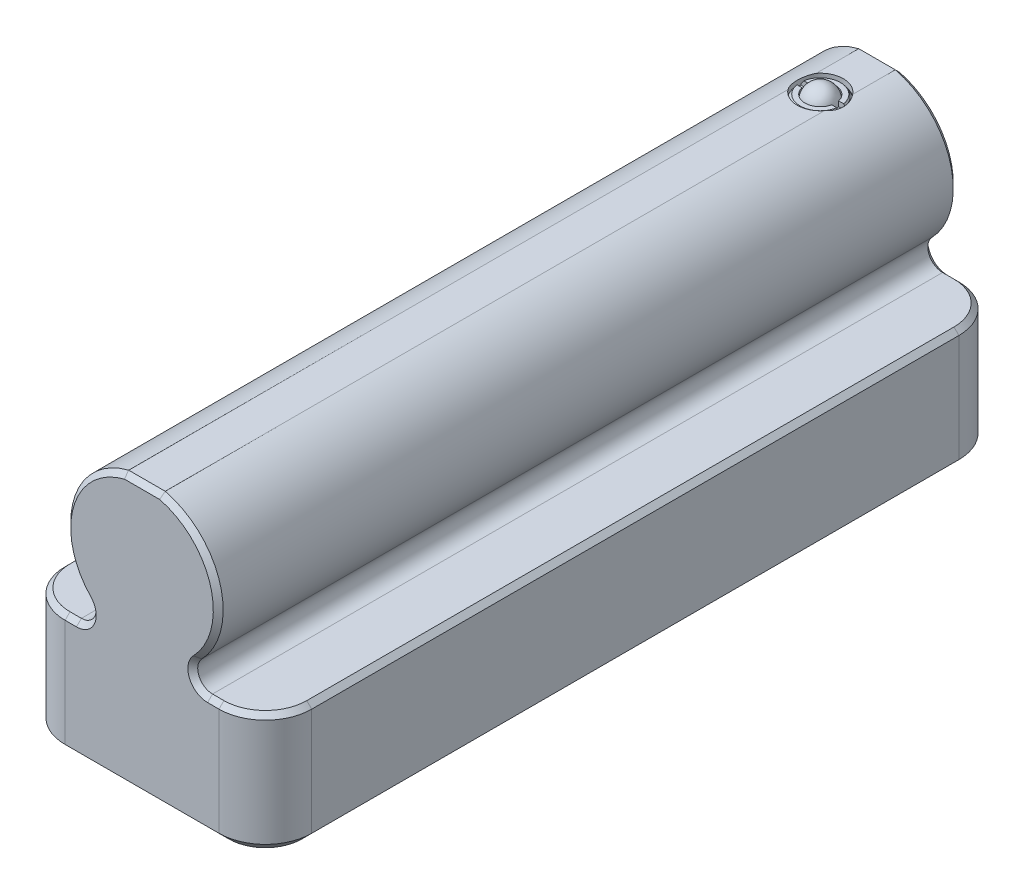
SolidWorks part; units mm, degrees
other "<4-48 DETENT>-<Imported1>"
other "<4-48 DETENT>-<Imported2>"
ref_plane "Front Plane" through (0, 0, 0) normal (0, 0, 1) x (1, 0, 0)
ref_plane "Top Plane" through (0, 0, 0) normal (0, 1, 0) x (1, 0, 0)
ref_plane "Right Plane" through (0, 0, 0) normal (1, 0, 0) x (0, 0, -1)
sketch "Sketch1" plane through (0, 0, 0) normal (0, 0, 1) x (1, 0, 0)
  line L0 (-6.35, 0) -> (-6.35, 6.2992)
  line L1 (-6.35, 6.2992) -> (-3.3751, 6.2992)
  line L2 (3.3751, 6.2992) -> (6.35, 6.2992)
  line L3 (6.35, 6.2992) -> (6.35, 0)
  line L4 (6.35, 0) -> (-6.35, 0)
  line L5 (0, 0) -> (0, 10.3124) construction
  line L7 (-0.9402, 14.1224) -> (0.9402, 14.1224)
  arc A0 (-3.3751, 6.2992) -> (-2.8263, 7.5899) centre (-3.3751, 7.0612) ccw
  arc A1 (-2.8263, 7.5899) -> (-0.9402, 14.1224) centre (0, 10.3124) cw
  arc A2 (2.8263, 7.5899) -> (3.3751, 6.2992) centre (3.3751, 7.0612) ccw
  arc A3 (0.9402, 14.1224) -> (2.8263, 7.5899) centre (0, 10.3124) cw
  dimension "D3" = 3.9243
  dimension "D4" = 14.1224
  dimension "D5" = 0.762
  dimension "D6" = 5.2261
  dimension "D1" = 6.2992
  dimension "D2" = 12.7
  dimension "D8" = 1.8805
  dimension "D9" = 4.0132
extrude "Boss-Extrude1" add sketch "Sketch1" along normal mid plane 38.1
fillet "Fillet1" radius 2.3876 4 edges at (-6.35, 3.1496, -19.05) (-6.35, 3.1496, 19.05) (6.35, 3.1496, -19.05) (6.35, 3.1496, 19.05)
chamfer "Chamfer1" distance 0.508 angle 45 8 edges at (0, 0, -19.05) (-5.6507, 0, -18.3507) (5.6507, 0, -18.3507) (-6.35, 0, 0) (6.35, 0, 0) (-5.6507, 0, 18.3507) (5.6507, 0, 18.3507) (0, 0, 19.05)
chamfer "Chamfer2" distance 0.254 angle 45 20 edges at (-5.6507, 6.2992, -18.3507) (-6.35, 6.2992, 0) (-3.6687, 6.2992, -19.05) (-5.6507, 6.2992, 18.3507) (-2.6738, 6.763, -19.05) (-3.6687, 6.2992, 19.05) (-3.7703, 11.4009, -19.05) (-2.6738, 6.763, 19.05) (2.6738, 6.763, -19.05) (-3.7703, 11.4009, 19.05) (3.6687, 6.2992, -19.05) (2.6738, 6.763, 19.05) (5.6507, 6.2992, -18.3507) (3.6687, 6.2992, 19.05) (6.35, 6.2992, 0) (5.6507, 6.2992, 18.3507) (0, 14.1224, 19.05) (0, 14.1224, -19.05) (3.7703, 11.4009, -19.05) (3.7703, 11.4009, 19.05)
hole_wizard "#10-32 Tapped Hole1" positions "Sketch2" profile "Sketch3" tap size "#10-32" standard "ANSI Inch"
sketch "Sketch2" plane through (0, 0, 0) normal (0, -1, 0) x (-1, 0, 0)
  line L0 (4.5244, 0) -> (-0.5669, 0) construction
  point P0 (0, 12.7)
  point P12 (0, -12.7)
  dimension "D1" = 12.7
sketch "Sketch3" plane through (0, 0, -12.7) normal (1, 0, 0) x (0, 0, -1)
  line L0 (0, 0) -> (0, 8.8333)
  line L1 (0, 8.8333) -> (2.0193, 7.62)
  line L2 (2.0193, 7.62) -> (2.0193, 0)
  line L5 (2.0193, 0) -> (0, 0)
  line L10 (0, 8.8333) -> (-2.0193, 7.62) construction
  line L11 (0, -6.35) -> (0, 107.95) construction
  dimension "Tap Drill Dia." = 4.0386
  dimension "Tap Drill Depth" = 7.62
  dimension "Drill Angle" = 118
ref_plane "Plane1" through (0, 14.2367, 0) normal (0, 1, 0) x (1, 0, 0)
hole_wizard "#4-48 Tapped Hole1" positions "Sketch4" profile "Sketch5" tap size "#4-48" standard "ANSI Inch"
sketch "Sketch4" plane through (0, 14.2367, 0) normal (0, -1, 0) x (-1, 0, 0)
  line L0 (-3.9624, 19.05) -> (3.9624, 19.05) construction
  point P0 (0, 15.875)
  dimension "D1" = 3.175
sketch "Sketch5" plane through (0, 14.2367, -15.875) normal (1, 0, 0) x (0, 0, 1)
  line L0 (0, 0) -> (0, 7.5715)
  line L1 (0, 7.5715) -> (1.1874, 6.858)
  line L2 (1.1874, 6.858) -> (1.1874, 0)
  line L3 (-0.7874, 14.2367) -> (-2.667, 14.2367) construction
  line L5 (1.1874, 0) -> (0, 0)
  line L10 (0, 7.5715) -> (-1.1875, 6.858) construction
  line L11 (0, -6.35) -> (0, 107.95) construction
  point P3 (0, -0.2921)
  dimension "Tap Drill Dia." = 2.3749
  dimension "Tap Drill Depth" = 6.858
  dimension "Drill Angle" = 118
inserted part "4-48 DETENT"
move or copy body "Body-Move/Copy2" placed by mates yes
